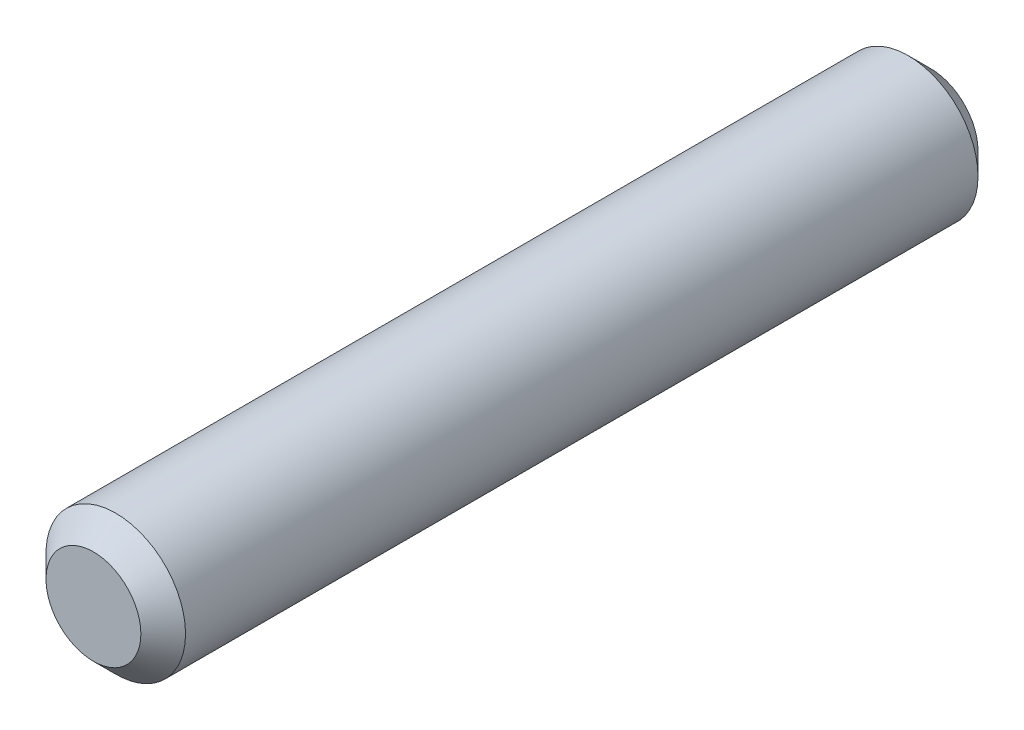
SolidWorks part; units mm, degrees
ref_plane "Front" through (0, 0, 0) normal (0, 0, 1) x (1, 0, 0)
ref_plane "Top" through (0, 0, 0) normal (0, 1, 0) x (1, 0, 0)
ref_plane "Right" through (0, 0, 0) normal (1, 0, 0) x (0, 0, -1)
sketch "Sketch1" plane through (0, 0, 0) normal (0, 0, 1) x (1, 0, 0)
  circle A0 centre (0, 0) radius 0.7937
  dimension "D1" = 1.5875
extrude "Boss-Extrude1" add sketch "Sketch1" along normal blind 4.7625 and the other way blind 4.7625
chamfer "Chamfer1" distance 0.254 angle 45 2 edges at (0.7937, 0, -4.7625) (0.7937, 0, 4.7625)
equation "\"Buoyancy\"=\"SW-Volume\"*(\"SW-Density\"-.037062)"
